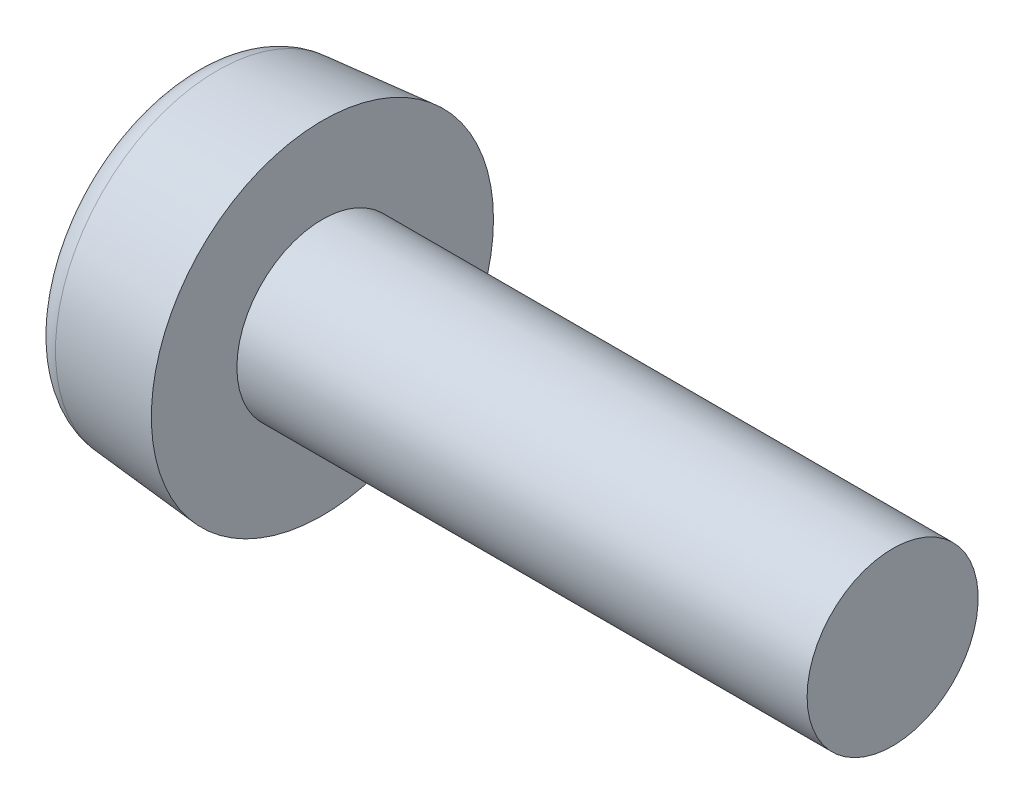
SolidWorks part; units mm, degrees
ref_plane "Front" through (0, 0, 0) normal (0, 0, 1) x (1, 0, 0)
ref_plane "Top" through (0, 0, 0) normal (0, 1, 0) x (1, 0, 0)
ref_plane "Right" through (0, 0, 0) normal (1, 0, 0) x (0, 0, -1)
ref_plane "Plane1" through (4.6, 0, 0) normal (1, 0, 0) x (0, 0, -1)
sketch "Sketch1" plane through (4.6, 0, 0) normal (1, 0, 0) x (0, 0, -1)
  circle A0 centre (0, 0) radius 6
  dimension "dk" = 12
extrude "BaseHead" add sketch "Sketch1" against normal blind 4.6 draft 5
sketch "Sketch2" plane through (4.6, 0, 0) normal (1, 0, 0) x (0, 0, -1)
  circle A0 centre (0, 0) radius 3
sketch "Sketch8" plane through (0, 0, 0) normal (0, 0, 1) x (1, 0, 0)
  line L0 (0, 0) -> (35.73, 0) construction
  line L1 (6.964, 0) -> (6.964, -2) construction
  line L2 (4.6, -6) -> (4.6, 6) construction
  line L3 (11.6578, 0) -> (11.6578, -2) construction
  line L4 (4.6, 3) -> (24.6, 3)
  line L5 (24.6, 3) -> (24.6, 0)
  line L7 (24.6, 0) -> (4.6, 0)
  line L9 (4.6, 3) -> (4.6, 0)
  arc A0 (6.7996, -0.1884) -> (7.1407, -0.1768) centre (6.964, 0) ccw construction
  dimension "r" = 0.25
  dimension "a" = 2
  dimension "d" = 6
  dimension "D4" = 2
  dimension "l" = 20
revolve "Revolve1" add sketch "Sketch8" angle 360 about L0
sketch "Sketch4" plane through (0, 0, 0) normal (1, 0, 0) x (0, 0, -1)
  line L1 (0, 2.3094) -> (-2, 1.1547) construction
  line L2 (-2, 1.1547) -> (-2, -1.1547) construction
  line L3 (-2, -1.1547) -> (0, -2.3094) construction
  line L4 (0, -2.3094) -> (2, -1.1547) construction
  line L5 (2, -1.1547) -> (2, 1.1547) construction
  line L6 (2, 1.1547) -> (0, 2.3094) construction
  line L7 (1, 1.7321) -> (-1, 1.7321) construction
  line L8 (-1, 1.7321) -> (-2, 0) construction
  line L9 (-2, 0) -> (-1, -1.7321) construction
  line L10 (-1, -1.7321) -> (1, -1.7321) construction
  line L11 (1, -1.7321) -> (2, 0) construction
  line L12 (2, 0) -> (1, 1.7321) construction
  circle A0 centre (0, 0) radius 2.3094 construction
  circle A1 centre (0, 0) radius 2 construction
  spline S0 degree 3 poles (0, 2.6647) (0.9231, 1.5988) (2.3077, 1.3323) (1.8462, 0) (2.3077, -1.3323) (0.9231, -1.5988) (0, -2.6647) (-0.9231, -1.5988) (-2.3077, -1.3323) (-1.8462, 0) (-2.3077, 1.3323) (-0.9231, 1.5988) (0, 2.6647) (0.9231, 1.5988) (2.3077, 1.3323) knots -0.25 -0.166667 -0.083333 0 0.083333 0.166667 0.25 0.333333 0.416667 0.5 0.583333 0.666667 0.75 0.833333 0.916667 1 1.083333 1.166667 1.25 only from (1, 1.7321) to (1, 1.7321)
  dimension "B" = 4
extrude "Socket" cut sketch "Sketch4" along normal blind 2
sketch "Sketch5" plane through (2, 0, 0) normal (-1, 0, 0) x (0, 0, 1)
  spline S1 degree 3 poles (0, 2.6647) (-0.9231, 1.5988) (-2.3077, 1.3323) (-1.8462, 0) (-2.3077, -1.3323) (-0.9231, -1.5988) (0, -2.6647) (0.9231, -1.5988) (2.3077, -1.3323) (1.8462, 0) (2.3077, 1.3323) (0.9231, 1.5988) (0, 2.6647) (-0.9231, 1.5988) (-2.3077, 1.3323) knots -0.25 -0.166667 -0.083333 0 0.083333 0.166667 0.25 0.333333 0.416667 0.5 0.583333 0.666667 0.75 0.833333 0.916667 1 1.083333 1.166667 1.25 only from (-1, 1.7321) to (-1, 1.7321)
  spline S2 degree 3 poles (0, 2.6647) (-0.9231, 1.5988) (-2.3077, 1.3323) (-1.8462, 0) (-2.3077, -1.3323) (-0.9231, -1.5988) (0, -2.6647) (0.9231, -1.5988) (2.3077, -1.3323) (1.8462, 0) (2.3077, 1.3323) (0.9231, 1.5988) (0, 2.6647) (-0.9231, 1.5988) (-2.3077, 1.3323) knots -0.25 -0.166667 -0.083333 0 0.083333 0.166667 0.25 0.333333 0.416667 0.5 0.583333 0.666667 0.75 0.833333 0.916667 1 1.083333 1.166667 1.25 only from (-1, 1.7321) to (-1, 1.7321)
  dimension "D1" = 0
ref_plane "Plane2" through (2.6667, 0, 0) normal (-1, 0, 0) x (0, 0, 1)
sketch "Sketch7" plane through (2.6667, 0, 0) normal (-1, 0, 0) x (0, 0, 1)
  point P0 (0, 0)
loft "Cut-Loft1" cut profiles "Sketch7", "Sketch5"
sketch "Sketch6" plane through (-30.7487, 13.2487, 0) normal (0, 0, 1) x (0, -1, 0)
  line L0 (13.2487, 89.8637) -> (13.2487, 24.8312) construction
  line L1 (-4.0013, 35.3487) -> (10.8987, 35.3487)
  line L2 (-4.0013, 35.3487) -> (-4.0013, 45.3487)
  line L3 (-4.0013, 45.3487) -> (10.2487, 45.3487)
  line L4 (10.9987, 35.4487) -> (10.9987, 43.3487)
  line L5 (16.2487, 55.3487) -> (10.2487, 55.3487) construction
  line L6 (10.2487, 45.3487) -> (10.9987, 43.3487)
  line L9 (19.2487, 35.3487) -> (7.2487, 35.3487) construction
  arc A0 (10.8987, 35.3487) -> (10.9987, 35.4487) centre (10.8987, 35.4487) ccw
  dimension "d1" = 4.5
  dimension "D2" = 15
  dimension "b" = 10
  dimension "D3" = 6
  dimension "x" = 2
fillet "HeadFillet2" radius 1 1 edges at (0, 0, -5.5976)
sketch "Sketch9" plane through (0, 0, 0) normal (0, 0, 1) x (1, 0, 0)
  line L0 (24.6, 2.3505) -> (24.975, 3)
  line L1 (24.975, 3) -> (24.975, 3.75)
  line L2 (24.975, 3.75) -> (24.225, 3.75)
  line L3 (24.225, 3.75) -> (24.225, 3)
  line L4 (24.225, 3) -> (24.6, 2.3505)
  line L5 (24.6, -3) -> (24.6, 3) construction
  line L6 (0, 0) -> (28.2938, 0) construction
  line L7 (0, 4.6812) -> (0, -4.6812) construction
  dimension "D1" = 0.75
  dimension "D2" = 6
revolve "Cut-Revolve10" [suppressed] cut sketch "Sketch9" angle 360 about L6
pattern_linear "LPattern10" [suppressed] count 20 spacing 0.9 along (1, 0, 0)
equation "\"D1@Plane1\"=\"k@BaseHead\""
equation "\"D1@Plane2\" = \"t@Socket\" / 3"
equation "\"D2@Sketch9\" =\"d@Sketch8\""
equation "\"D1@Sketch9\" =  ( \"d@Sketch8\" - \"THD_MINOR@ThreadCosmetic1\" )  / 2"
equation "\"D3@LPattern10\" = \"D1@Sketch9\" * 1.2"
equation "\"D1@LPattern10\" = \"bb@ThreadCosmetic1\" / \"D3@LPattern10\" "
equation "\"D3@Sketch6\" = \"d@Sketch8\""
